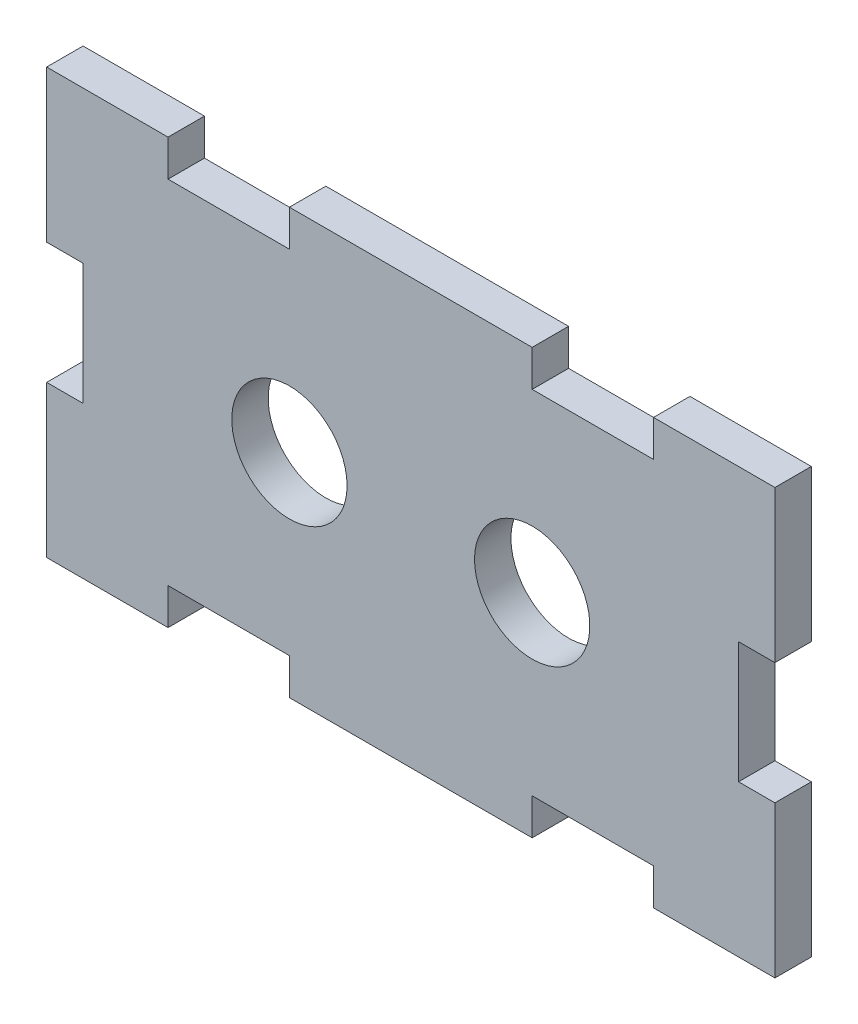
SolidWorks part; units mm, degrees
ref_plane "Alzado" through (0, 0, 0) normal (0, 0, 1) x (1, 0, 0)
ref_plane "Planta" through (0, 0, 0) normal (0, 1, 0) x (1, 0, 0)
ref_plane "Vista lateral" through (0, 0, 0) normal (1, 0, 0) x (0, 0, -1)
sketch "Croquis1" plane through (0, 0, 0) normal (0, 0, 1) x (1, 0, 0)
  line L0 (-30, 0) -> (30, 0) construction
  line L1 (-30, -17.5) -> (30, -17.5)
  line L2 (-30, -17.5) -> (-30, 17.5)
  line L3 (-30, 17.5) -> (30, 17.5)
  line L4 (30, -17.5) -> (30, 17.5)
  line L5 (0, 17.5) -> (0, -17.5) construction
  circle A2 centre (-10, 0) radius 4.75
  circle A3 centre (10, 0) radius 4.75
  point P15 (0, 0)
extrude "Saliente-Extruir2" add sketch "Croquis1" along normal blind 3
sketch "Croquis2" plane through (0, 0, 3) normal (0, 0, 1) x (1, 0, 0)
  line L0 (-20, 17.5) -> (-10, 17.5)
  line L1 (-20, 17.5) -> (-20, 14.5)
  line L2 (-10, 17.5) -> (-10, 14.5)
  line L3 (-20, 14.5) -> (-10, 14.5)
  line L4 (30, 17.5) -> (-30, 17.5) construction
  point P8 (-15, 14.5)
extrude "Cortar-Extruir1" cut sketch "Croquis2" against normal up to surface (3 mm away)
mirror "Simetría1" about plane through (0, 0, 0) normal (1, 0, 0) of "Cortar-Extruir1"
mirror "Simetría2" about plane through (0, 0, 0) normal (0, 1, 0) of "Simetría1", "Cortar-Extruir1"
sketch "Croquis3" plane through (0, 0, 3) normal (0, 0, 1) x (1, 0, 0)
  line L0 (-30, 5) -> (-27, 5)
  line L1 (-30, 5) -> (-30, -5)
  line L2 (-27, 5) -> (-27, -5)
  line L3 (-30, -5) -> (-27, -5)
  line L4 (-30, 17.5) -> (-30, -17.5) construction
  line L5 (30, -17.5) -> (30, 17.5) construction
  point P6 (-27, 0)
  point P9 (30, 0)
extrude "Cortar-Extruir2" cut sketch "Croquis3" against normal up to surface (3 mm away)
mirror "Simetría3" about plane through (0, 0, 0) normal (1, 0, 0) of "Cortar-Extruir2"
equation "\"Ancho\"= 60"
equation "\"alto\"= 35"
equation "\"D2@Croquis1\"=\"Ancho\""
equation "\"D1@Croquis1\"=\"alto\""
equation "\"D2@Croquis2\"=\"Ancho\"/6"
equation "\"D3@Croquis2\"=\"Ancho\"/4"
equation "\"grosor\"= 3"
equation "\"D1@Saliente-Extruir2\"=\"grosor\""
equation "\"D1@Croquis3\"=\"grosor\""
equation "\"D2@Croquis3\"=\"alto\"/3.5"
equation "\"D1@Croquis2\"=\"grosor\""
